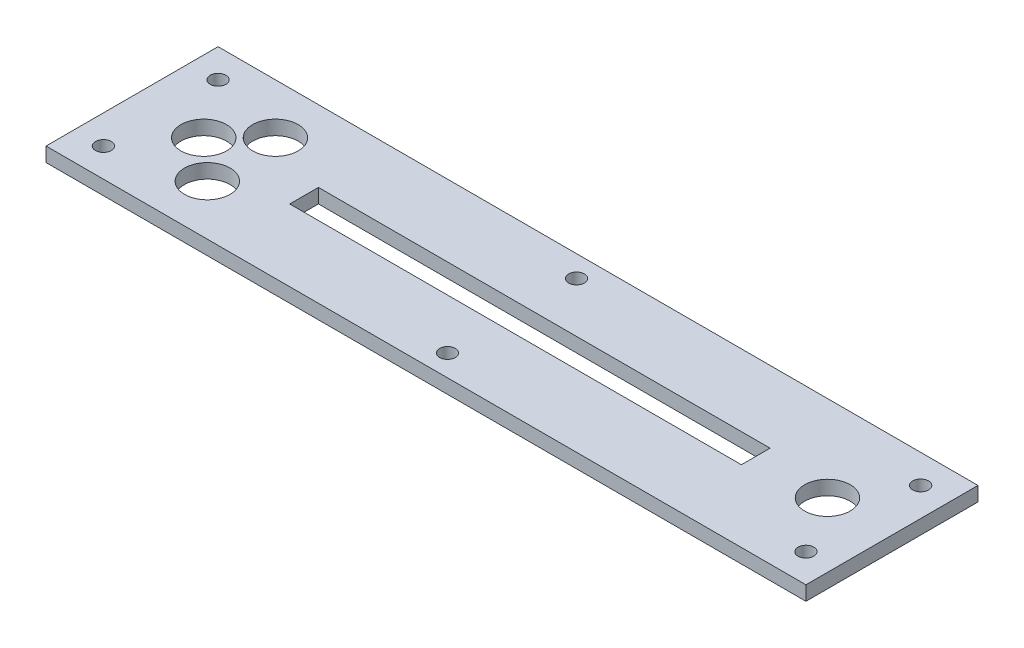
SolidWorks part; units mm, degrees
ref_plane "Front Plane" through (0, 0, 0) normal (0, 0, 1) x (1, 0, 0)
ref_plane "Top Plane" through (0, 0, 0) normal (0, 1, 0) x (1, 0, 0)
ref_plane "Right Plane" through (0, 0, 0) normal (1, 0, 0) x (0, 0, -1)
sketch "Sketch1" plane through (0, 0, 0) normal (0, 1, 0) x (1, 0, 0)
  line L0 (-53.5, 12) -> (-53.5, -12)
  line L1 (52.5, -12) -> (-53.5, -12)
  line L2 (52.5, -12) -> (52.5, 12)
  line L3 (52.5, 12) -> (-53.5, 12)
  line L5 (-29.5, 2) -> (33.5, 2)
  line L6 (-29.5, 2) -> (-29.5, -2)
  line L7 (-29.5, -2) -> (33.5, -2)
  line L8 (33.5, 2) -> (33.5, -2)
  circle A0 centre (-38.5, 5) radius 3.18
  circle A1 centre (-43.5, 0) radius 3.18
  circle A2 centre (-38, -5) radius 3.18
  circle A3 centre (43.5, 0) radius 3.18
  circle A4 centre (-49.5, 8) radius 1.1
  circle A5 centre (-49.5, -8) radius 1.1
  circle A6 centre (48.5, -8) radius 1.1
  circle A7 centre (48.5, 8) radius 1.1
  circle A10 centre (-0.5, -9) radius 1.1
  circle A11 centre (-0.5, 9) radius 1.1
  dimension "D3" = 10
  dimension "D4" = 4
  dimension "D5" = 4
  dimension "D7" = 10
  dimension "D1" = 4
  dimension "D12" = 3
  dimension "D2" = 10
  dimension "D6" = 4
  dimension "D8" = 4
  dimension "D9" = 4
  dimension "D10" = 4
  dimension "D11" = 4
  dimension "D13" = 3
extrude "Boss-Extrude1" add sketch "Sketch1" along normal blind 2
